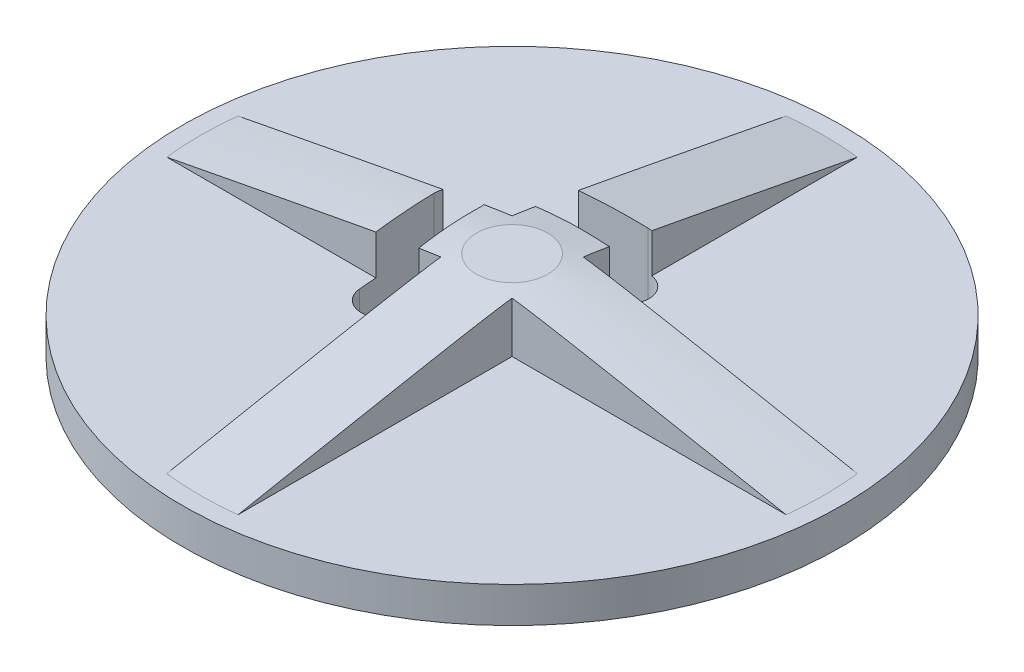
SolidWorks part; units mm, degrees
ref_plane "Front Plane" through (0, 0, 0) normal (0, 0, 1) x (1, 0, 0)
ref_plane "Top Plane" through (0, 0, 0) normal (0, 1, 0) x (1, 0, 0)
ref_plane "Right Plane" through (0, 0, 0) normal (1, 0, 0) x (0, 0, -1)
sketch "Sketch1" plane through (0, 0, 0) normal (1, 0, 0) x (0, 0, -1)
  line L0 (0, 0) -> (0, 135.3346) construction
  line L1 (190.5, -25.4) -> (190.5, 0)
  line L2 (190.5, 0) -> (234.95, 0)
  line L3 (234.95, 0) -> (234.95, 25.4)
  line L5 (190.5, -25.4) -> (177.8, -25.4)
  line L6 (177.8, -25.4) -> (177.8, 0)
  line L7 (177.8, 0) -> (0, 0)
  line L8 (0, 0) -> (0, 63.5)
  line L9 (234.95, 25.4) -> (222.25, 25.4)
  line L11 (0, 63.5) -> (25.4, 63.5)
  line L12 (25.4, 63.5) -> (222.25, 25.4)
  dimension "D1" = 190.5
  dimension "D2" = 234.95
  dimension "D3" = 25.4
  dimension "D4" = 25.4
  dimension "D5" = 63.5
  dimension "D6" = 12.7
  dimension "D7" = 12.7
  dimension "D8" = 25.4
revolve "Revolve1" add sketch "Sketch1" angle 360 about L0
sketch "Sketch2" plane through (0, 63.5, 0) normal (0, 1, 0) x (1, 0, 0)
  line L0 (25.4, 0) -> (25.4, -233.573)
  line L1 (-25.4, 0) -> (-25.4, 233.573)
  line L2 (0, 25.4) -> (233.573, 25.4)
  line L3 (0, -25.4) -> (-233.573, -25.4)
  line L4 (-25.4, 25.4) -> (-233.573, 25.4)
  line L5 (25.4, 25.4) -> (25.4, 233.573)
  line L6 (25.4, -25.4) -> (233.573, -25.4)
  line L7 (-25.4, -25.4) -> (-25.4, -233.573)
  circle A0 centre (0, 0) radius 234.95 construction
  circle A1 centre (0, 0) radius 234.95
  circle A2 centre (0, 0) radius 25.4 construction
  circle A3 centre (0, 0) radius 25.4
extrude "Cut-Extrude1" cut sketch "Sketch2" against normal up to surface (38.1 mm away) contours L2 A1 L5 | L0 A1 L6 | L3 A1 L7 | L1 A1 L4
sketch "Sketch4" plane through (0, 0, 0) normal (0, -1, 0) x (1, 0, 0)
  line L0 (-60.0489, -20.6491) -> (-55.5031, 36.8286) construction
  line L3 (-75.2414, -19.4476) -> (-70.6957, 38.0301)
  line L6 (-44.8563, -21.8506) -> (-40.3106, 35.6271)
  line L7 (-34.3834, -57.0502) -> (23.2375, -59.0954) construction
  line L8 (-33.8428, -41.8198) -> (23.7781, -43.865)
  line L9 (-34.924, -72.2806) -> (22.697, -74.3258)
  arc A4 (-75.2414, -19.4476) -> (-44.8563, -21.8506) centre (-60.0489, -20.6491) ccw
  arc A5 (-40.3106, 35.6271) -> (-70.6957, 38.0301) centre (-55.5031, 36.8286) ccw
  arc A6 (-33.8428, -41.8198) -> (-34.924, -72.2806) centre (-34.3834, -57.0502) ccw
  arc A7 (22.697, -74.3258) -> (23.7781, -43.865) centre (23.2375, -59.0954) ccw
  point P2 (0, 0)
  point P3 (0, 0)
  point P4 (-57.776, 8.0898)
  point P11 (-5.5729, -58.0728)
  point P12 (0, 0)
  point P13 (0, 0)
  dimension "D1" = 15.24
  dimension "D2" = 15.24
  dimension "D3" = 55.5031
  dimension "D4" = 36.8286
  dimension "D5" = 57.6572
  dimension "D6" = 60.0489
  dimension "D7" = 34.3834
  dimension "D8" = 57.0502
  dimension "D9" = 59.0954
  dimension "D10" = 57.6209
extrude "Cut-Extrude3" cut sketch "Sketch4" against normal through all
